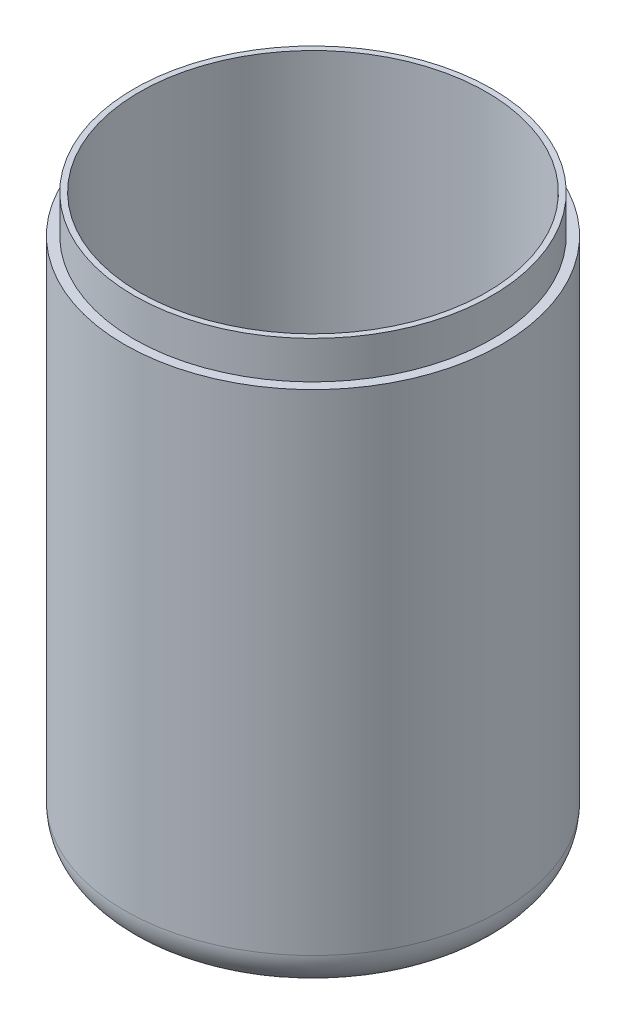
SolidWorks part; units mm, degrees
ref_plane "Plan de face" through (0, 0, 0) normal (0, 0, 1) x (1, 0, 0)
ref_plane "Plan de dessus" through (0, 0, 0) normal (0, 1, 0) x (1, 0, 0)
ref_plane "Plan de droite" through (0, 0, 0) normal (1, 0, 0) x (0, 0, -1)
sketch "Esquisse1" plane through (0, 0, 0) normal (0, 1, 0) x (1, 0, 0)
  circle A0 centre (5.8932, -2.0839) radius 50
  dimension "D1" = 100
extrude "Boss.-Extru.1" add sketch "Esquisse1" along normal blind 150
sketch "Esquisse2" plane through (0, 150, 0) normal (0, 1, 0) x (1, 0, 0)
  circle A0 centre (5.8932, -2.0839) radius 47.5
  circle A1 centre (5.8932, -2.0839) radius 46
  circle A2 centre (5.8932, -2.0839) radius 50
  dimension "D1" = 95
  dimension "D2" = 92
extrude "Enlèv. mat.-Extru.1" cut sketch "Esquisse2" against normal blind 10 contours A0 M1
sketch "Esquisse3" plane through (0, 150, 0) normal (0, 1, 0) x (1, 0, 0)
  circle A0 centre (5.8932, -2.0839) radius 46.0288
extrude "Enlèv. mat.-Extru.2" cut sketch "Esquisse3" against normal blind 133
fillet "Congé1" radius 10 1 edges at (5.8932, 0, 52.0839)
